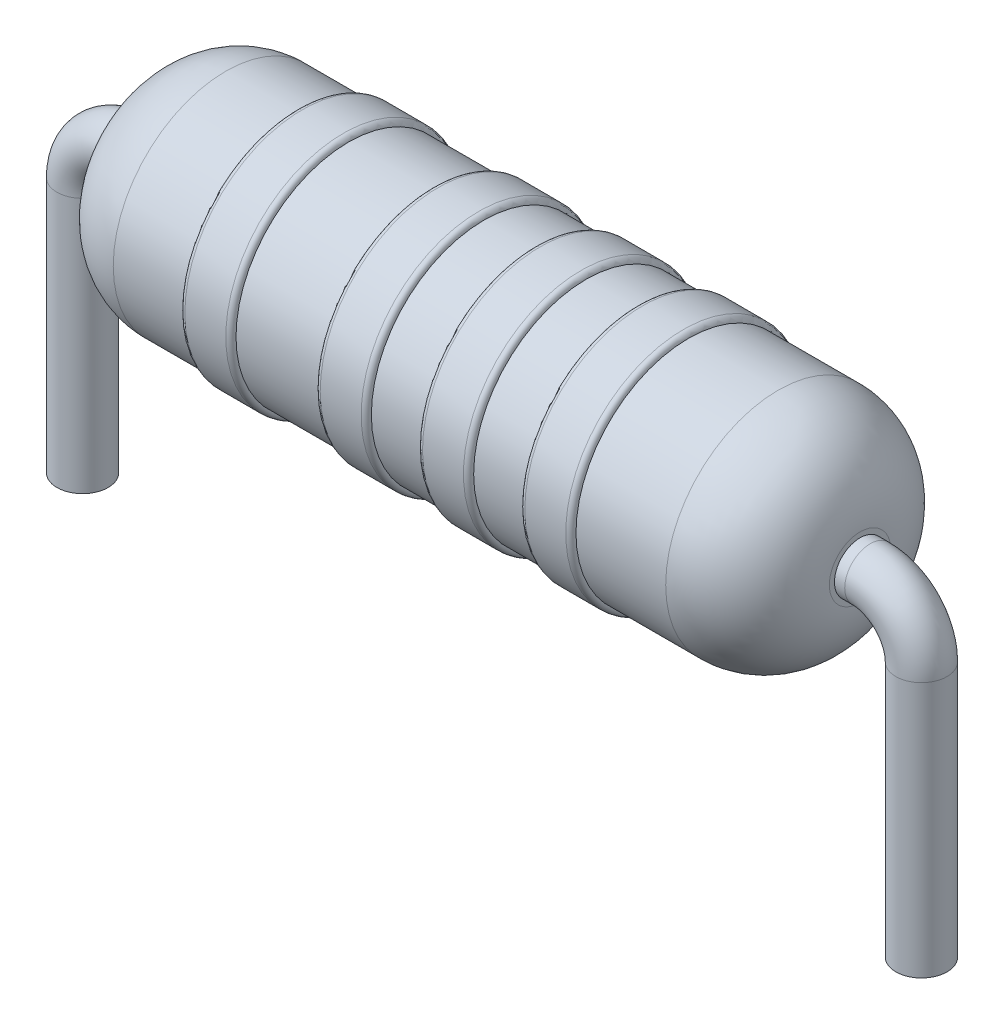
SolidWorks part; units mm, degrees
ref_plane "Face" through (0, 0, 0) normal (0, 0, 1) x (1, 0, 0)
ref_plane "Dessus" through (0, 0, 0) normal (0, 1, 0) x (1, 0, 0)
ref_plane "Droite" through (0, 0, 0) normal (1, 0, 0) x (0, 0, -1)
sketch "Esquisse1" plane through (0, 0, 0) normal (0, 0, 1) x (1, 0, 0)
  line L0 (-54.2687, 0) -> (62.1733, 0) construction
  line L1 (-48.4922, 1.1) -> (45.7559, 1.1) construction
  line L2 (-3.5, -1.6411) -> (-3.5, 4.3175) construction
  line L3 (0, -1.0268) -> (0, 4.1947) construction
  line L4 (3.5, 3.6009) -> (3.5, -1.9687) construction
  line L5 (-3.5, 0) -> (-3.5, 0.3)
  line L6 (-2.7, 1.1) -> (2.7, 1.1)
  line L7 (3.5, 0.3) -> (3.5, 0)
  line L8 (3.5, 0) -> (-3.5, 0)
  arc A0 (-2.7, 1.1) -> (-3.5, 0.3) centre (-2.7, 0.3) ccw
  arc A1 (3.5, 0.3) -> (2.7, 1.1) centre (2.7, 0.3) ccw
revolve "Base-Révolution" add sketch "Esquisse1" angle 360 about L0
sketch "Esquisse2" plane through (0, 0, 0) normal (0, 0, 1) x (1, 0, 0)
  line L0 (-3.3896, 1.15) -> (3.161, 1.15) construction
  line L1 (-2, 1.3889) -> (-2, -0.1179) construction
  line L2 (-1.5, 1.4925) -> (-1.5, -0.2136) construction
  line L3 (4.3262, 0) -> (-3.8651, 0) construction
  line L4 (1.323, 0) -> (1.823, 0)
  line L5 (0.323, 0) -> (0.823, 0)
  line L6 (-0.677, 1.15) -> (-0.677, 0)
  line L7 (0.323, 1.15) -> (0.323, 0)
  line L8 (1.323, 1.15) -> (1.323, 0)
  line L9 (-0.177, 1.15) -> (-0.177, 0)
  line L10 (0.823, 1.15) -> (0.823, 0)
  line L11 (1.823, 1.15) -> (1.823, 0)
  line L12 (-0.677, 0) -> (-0.177, 0)
  line L13 (-0.677, 1.15) -> (-0.177, 1.15)
  line L14 (0.323, 1.15) -> (0.823, 1.15)
  line L15 (1.323, 1.15) -> (1.823, 1.15)
  line L16 (-2, 1.15) -> (-1.5, 1.15)
  line L17 (-1.5, 1.15) -> (-1.5, 0)
  line L18 (-1.5, 0) -> (-2, 0)
  line L19 (-2, 0) -> (-2, 1.15)
revolve "Boss.-Révol.1" add sketch "Esquisse2" angle 360 about L3
fillet "Congé1" radius 0.05 8 edges at (-0.177, 0, -1.15) (-0.677, 0, -1.15) (0.823, 0, -1.15) (0.323, 0, -1.15) (1.823, 0, -1.15) (1.323, 0, -1.15) (-1.5, 0, -1.15) (-2, 0, -1.15)
sketch "Esquisse3" plane through (-3.5, 0, 0) normal (-1, 0, 0) x (0, 0, 1)
  circle A0 centre (0, 0) radius 0.25
sketch "Esquisse4" plane through (0, 0, 0) normal (0, 0, 1) x (1, 0, 0)
  line L0 (-3.1075, 0) -> (-5.8186, 0) construction
  line L1 (0, -2.524) -> (0, 3.2043) construction
  line L2 (-5.9326, -3) -> (3.6667, -3) construction
  line L3 (-4.1, 1.6795) -> (-4.1, -3.4934) construction
  line L4 (-3.5, 0) -> (-3.6, 0)
  line L5 (-4.1, -0.5) -> (-4.1, -3)
  arc A0 (-3.6, 0) -> (-4.1, -0.5) centre (-3.6, -0.5) ccw
  point P12 (-4.1, 0)
  dimension "D3" = 0.5
  dimension "D1" = 3
  dimension "D2" = 4.1
sweep "Balayage1" add profiles "Esquisse3" path "Esquisse4"
ref_plane "Plan1" through (0, 0, 0) normal (1, 0, 0) x (0, 0, -1)
mirror "Symétrie1" about plane through (0, 0, 0) normal (1, 0, 0) of "Balayage1"
